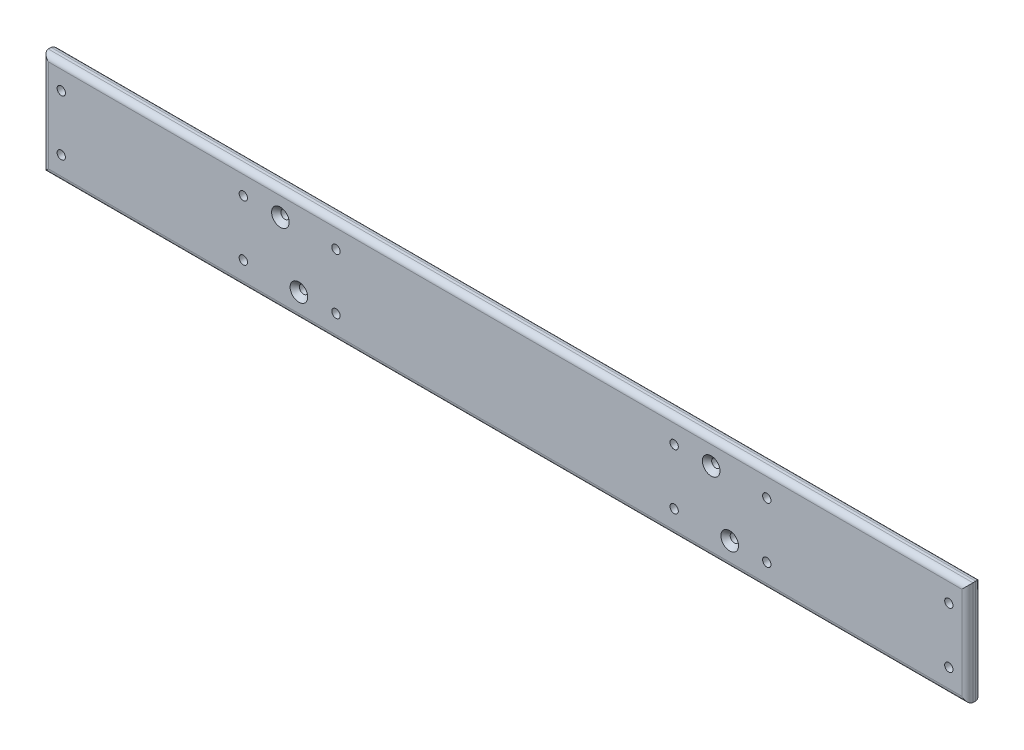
SolidWorks part; units mm, degrees
ref_plane "Plan1" through (0, 0, 0) normal (0, 0, 1) x (1, 0, 0)
ref_plane "Plan2" through (0, 0, 0) normal (0, 1, 0) x (1, 0, 0)
ref_plane "Plan3" through (0, 0, 0) normal (1, 0, 0) x (0, 0, -1)
sketch "Esquisse1" plane through (0, 0, 0) normal (0, 0, 1) x (1, 0, 0)
  line L0 (501, 112) -> (1499, 112)
  line L1 (501, 112) -> (501, 0)
  line L2 (1499, 0) -> (501, 0)
  line L3 (1499, 0) -> (1499, 112)
  circle A0 centre (717.5, 86) radius 4.5
  circle A1 centre (757.5, 86) radius 4.5
  circle A2 centre (777.5, 26) radius 4.5
  circle A3 centre (1222.5, 86) radius 4.5
  circle A4 centre (521, 86) radius 4.5
  circle A5 centre (521, 26) radius 4.5
  circle A6 centre (1479, 86) radius 4.5
  circle A7 centre (1479, 26) radius 4.5
  circle A8 centre (1242.5, 26) radius 4.5
  circle A10 centre (1182.5, 86) radius 4.5
  circle A11 centre (1182.5, 26) radius 4.5
  circle A12 centre (1282.5, 26) radius 4.5
  circle A13 centre (1282.5, 86) radius 4.5
  circle A14 centre (717.5, 26) radius 4.5
  circle A15 centre (817.5, 26) radius 4.5
  circle A16 centre (817.5, 86) radius 4.5
  point P10 (501, 0)
  point P13 (1499, 112)
  point P16 (1499, 0)
  dimension "D3" = 465
  dimension "D4" = 60
  dimension "D7" = 9
  dimension "D1" = 112
  dimension "D2" = 998
  dimension "D5" = 196.5
  dimension "D6" = 20
  dimension "D8" = 60
  dimension "D9" = 26
  dimension "D10" = 20
  dimension "D11" = 20
  dimension "D12" = 40
  dimension "D13" = 196.5
  dimension "D14" = 365
  dimension "D15" = 100
  dimension "D16" = 100
  dimension "D18" = 20
  dimension "D19" = 40
extrude "Base-Extrusion" add sketch "Esquisse1" along normal blind 15
fillet "Congé1" radius 6
chamfer "Chanfrein1" distance 5 angle 45
